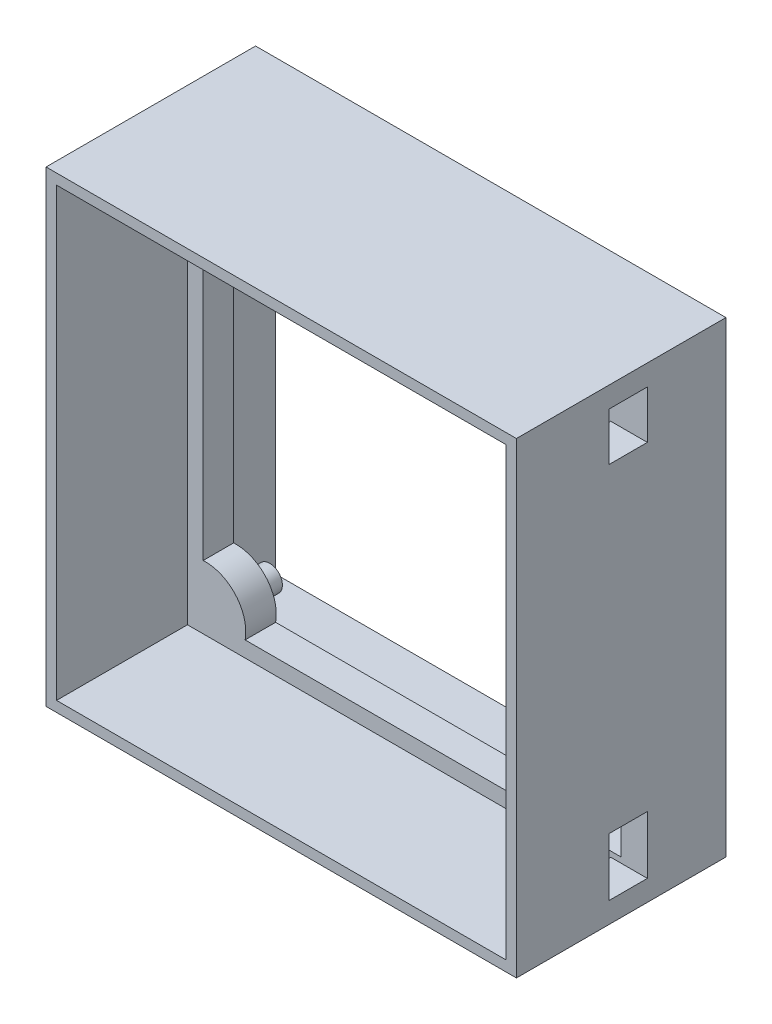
SolidWorks part; units mm, degrees
ref_plane "Front Plane" through (0, 0, 0) normal (0, 0, 1) x (1, 0, 0)
ref_plane "Top Plane" through (0, 0, 0) normal (0, 1, 0) x (1, 0, 0)
ref_plane "Right Plane" through (0, 0, 0) normal (1, 0, 0) x (0, 0, -1)
sketch "Sketch1" plane through (0, 0, 0) normal (0, 0, 1) x (1, 0, 0)
  line L0 (-44.9, -44.6) -> (-44.9, 44.6)
  line L1 (-39.9, -39.6) -> (39.9, -39.6)
  line L2 (-39.9, -39.6) -> (-39.9, 39.6)
  line L3 (-39.9, 39.6) -> (39.9, 39.6)
  line L4 (39.9, -39.6) -> (39.9, 39.6)
  line L5 (-39.9, -39.6) -> (39.9, 39.6) construction
  line L6 (-39.9, 39.6) -> (39.9, -39.6) construction
  line L7 (-44.9, 44.6) -> (44.9, 44.6)
  line L8 (44.9, -44.6) -> (44.9, 44.6)
  line L9 (-44.9, -44.6) -> (44.9, -44.6)
  point P0 (0, 0)
  dimension "D1" = 79.2
  dimension "D2" = 79.8
  dimension "D3" = 5
extrude "Boss-Extrude1" add sketch "Sketch1" along normal blind 40
sketch "Sketch2" plane through (0, 0, 40) normal (0, 0, 1) x (1, 0, 0)
  line L0 (39.9, -39.6) -> (39.9, 39.6) construction
  line L1 (39.9, 39.6) -> (-39.9, 39.6) construction
  line L2 (31.8973, 39.6) -> (39.9, 39.6)
  line L3 (39.9, 39.6) -> (39.9, 30.4655)
  line L4 (39.9, 0) -> (35.9467, 0)
  line L5 (39.9, -39.6) -> (39.9, -30.4655)
  line L6 (31.8973, -39.6) -> (39.9, -39.6)
  line L7 (0, 39.6) -> (0, 51.3482) construction
  line L8 (-31.8973, -39.6) -> (-39.9, -39.6)
  line L9 (-39.9, -39.6) -> (-39.9, -30.4655)
  line L10 (-39.9, 0) -> (-35.9467, 0)
  line L11 (-39.9, 39.6) -> (-39.9, 30.4655)
  line L12 (-31.8973, 39.6) -> (-39.9, 39.6)
  arc A0 (39.9, 30.4655) -> (31.8973, 39.6) centre (37.6432, 36.5611) cw
  arc A1 (39.9, -30.4655) -> (31.8973, -39.6) centre (37.6432, -36.5611) ccw
  arc A2 (-39.9, -30.4655) -> (-31.8973, -39.6) centre (-37.6432, -36.5611) cw
  arc A3 (-39.9, 30.4655) -> (-31.8973, 39.6) centre (-37.6432, 36.5611) ccw
  dimension "D1" = 6.5
extrude "Boss-Extrude2" add sketch "Sketch2" against normal blind 30.82 contours A3 M10 M7 | A0 M8 M7 | A2 M10 M9
sketch "Sketch3" plane through (0, 0, 40) normal (0, 0, 1) x (1, 0, 0)
  line L0 (-31.8973, -39.6) -> (39.9, -39.6) construction
  line L1 (30.704, -39.6) -> (20.704, -39.6)
  line L2 (30.704, -39.6) -> (30.704, -30.067)
  line L3 (30.704, -30.067) -> (20.704, -30.067)
  line L4 (20.704, -39.6) -> (20.704, -30.067)
  dimension "D1" = 10
extrude "Boss-Extrude3" add sketch "Sketch3" against normal blind 30.82 separate body
sketch "Sketch4" plane through (0, 0, 40) normal (0, 0, 1) x (1, 0, 0)
  line L0 (31.8973, 39.6) -> (-31.8973, 39.6) construction
  line L1 (39.9, -39.6) -> (-39.9, -39.6)
  line L2 (39.9, -39.6) -> (39.9, 39.6)
  line L3 (39.9, 39.6) -> (-39.9, 39.6)
  line L4 (-39.9, -39.6) -> (-39.9, 39.6)
  line L5 (-39.9, 30.4655) -> (-39.9, -30.4655) construction
  dimension "D1" = 0
  dimension "D2" = 0
extrude "Cut-Extrude1" cut sketch "Sketch4" against normal blind 25
sketch "Sketch6" plane through (0, 0, 9.18) normal (0, 0, -1) x (-1, 0, 0)
  line L0 (0, 39.6) -> (0, 35.6)
  line L1 (-39.9, 39.6) -> (39.9, 39.6) construction
  circle A0 centre (-36, 35.6) radius 7
  circle A1 centre (-36, 35.6) radius 2.25
  circle A3 centre (35.8, 35.4) radius 2.25
  circle A4 centre (35.5, -35.3) radius 2.25
  circle A5 centre (-26.2, -34.8) radius 2.25
  dimension "D1" = 14
  dimension "D2" = 4.5
  dimension "D3" = 4.5
  dimension "D4" = 4.5
  dimension "D5" = 4.5
extrude "Boss-Extrude4" add sketch "Sketch6" along normal blind 2.5 contours A1 | A3 | A4 | A5
sketch "Sketch7" plane through (0, 0, 15) normal (0, 0, 1) x (1, 0, 0)
  line L0 (-39.9, 0) -> (-37.6432, 0)
  line L1 (-39.9, 39.6) -> (-39.9, -39.6) construction
  arc A0 (-31.8973, -39.6) -> (-39.9, -30.4655) centre (-37.6432, -36.5611) ccw
  arc A1 (-31.8973, -39.6) -> (-39.9, -30.4655) centre (-39.5186, -38.2041) ccw
  arc A2 (-31.8973, 39.6) -> (-39.9, 30.4655) centre (-39.5186, 38.2041) cw
  arc A3 (-31.8973, 39.6) -> (-39.9, 30.4655) centre (-37.6432, 36.5611) cw
extrude "Cut-Extrude2" cut sketch "Sketch7" against normal blind 18 contours A3 A2 | A1 M2
sketch "Sketch8" plane through (0, 0, 6.68) normal (0, 0, -1) x (-1, 0, 0)
  circle A0 centre (-26.2, -34.8) radius 2.25
  circle A1 centre (-26.2, -34.8) radius 2.4
  circle A2 centre (-36, 35.6) radius 2.4
  circle A3 centre (35.8, 35.4) radius 2.4
  circle A4 centre (35.5, -35.3) radius 2.4
  dimension "D1" = 4.8
  dimension "D2" = 4.8
  dimension "D3" = 4.8
  dimension "D4" = 4.8
extrude "Boss-Extrude5" add sketch "Sketch8" against normal up to surface (8.32 mm away)
sketch "Sketch9" plane through (0, 0, 0) normal (0, 0, -1) x (-1, 0, 0)
  line L0 (-41.1, -40.8) -> (41.1, -40.8)
  line L1 (-39.9, -39.6) -> (39.9, -39.6)
  line L2 (-39.9, -39.6) -> (-39.9, 39.6)
  line L3 (-39.9, 39.6) -> (39.9, 39.6)
  line L4 (39.9, -39.6) -> (39.9, 39.6)
  line L5 (41.1, -40.8) -> (41.1, 40.8)
  line L6 (-41.1, 40.8) -> (41.1, 40.8)
  line L7 (-41.1, -40.8) -> (-41.1, 40.8)
  dimension "D1" = 1.2
extrude "Cut-Extrude3" cut sketch "Sketch9" against normal up to surface (9.18 mm away)
sketch "Sketch10" plane through (0, 0, 40) normal (0, 0, 1) x (1, 0, 0)
  line L0 (42.9, 42.6) -> (-42.9, 42.6)
  line L1 (39.9, 39.6) -> (-39.9, 39.6)
  line L2 (39.9, 39.6) -> (39.9, -39.6)
  line L3 (39.9, -39.6) -> (-39.9, -39.6)
  line L4 (-39.9, 39.6) -> (-39.9, -39.6)
  line L5 (-42.9, 42.6) -> (-42.9, -42.6)
  line L6 (42.9, -42.6) -> (-42.9, -42.6)
  line L7 (42.9, 42.6) -> (42.9, -42.6)
  dimension "D1" = 3
extrude "Cut-Extrude4" cut sketch "Sketch10" against normal up to surface (25 mm away)
sketch "Sketch11" plane through (42.9, 0, 0) normal (-1, 0, 0) x (0, 0, 1)
  line L0 (15, 42.6) -> (15, -42.6) construction
  line L1 (15, 40.63) -> (22.33, 40.63)
  line L2 (15, 40.63) -> (15, 31.46)
  line L3 (15, 31.46) -> (22.33, 31.46)
  line L4 (22.33, 40.63) -> (22.33, 31.46)
  line L5 (15, 42.6) -> (40, 42.6) construction
  line L6 (15, -42.6) -> (40, -42.6) construction
  line L7 (15, -40.63) -> (22.3, -40.63)
  line L8 (15, -40.63) -> (15, -29.57)
  line L9 (15, -29.57) -> (22.3, -29.57)
  line L10 (22.3, -40.63) -> (22.3, -29.57)
extrude "Cut-Extrude5" cut sketch "Sketch11" against normal blind 6
sketch "Sketch12" plane through (42.9, 0, 0) normal (-1, 0, 0) x (0, 0, 1)
  line L39 (15, 42.63) -> (15, 40.63)
  line L40 (15, 40.63) -> (22.33, 40.63)
  line L41 (22.33, 40.63) -> (22.33, 31.46)
  line L42 (15, 29.46) -> (24.33, 29.46)
  line L43 (24.33, 42.63) -> (15, 42.63)
  line L44 (24.33, 29.46) -> (24.33, 42.63)
  line L45 (15, 29.46) -> (24.33, 29.46)
  line L46 (24.33, 42.63) -> (15, 42.63)
  line L47 (24.33, 29.46) -> (24.33, 42.63)
  line L48 (22.33, 31.46) -> (15, 31.46)
  line L49 (15, 31.46) -> (15, 29.46)
  line L56 (15, -27.57) -> (15, -29.57)
  line L57 (15, -29.57) -> (22.3, -29.57)
  line L58 (22.3, -29.57) -> (22.3, -40.63)
  line L59 (15, -42.63) -> (24.3, -42.63)
  line L60 (24.3, -27.57) -> (15, -27.57)
  line L61 (24.3, -42.63) -> (24.3, -27.57)
  line L62 (15, -42.63) -> (24.3, -42.63)
  line L63 (24.3, -27.57) -> (15, -27.57)
  line L64 (24.3, -42.63) -> (24.3, -27.57)
  line L65 (22.3, -40.63) -> (15, -40.63)
  line L66 (15, -40.63) -> (15, -42.63)
  dimension "D1" = 2
  dimension "D2" = 2
extrude "Boss-Extrude6" add sketch "Sketch12" along normal blind 5
sketch "Sketch13" plane through (0, 0, 40) normal (0, 0, 1) x (1, 0, 0)
  line L17 (-44.9, -44.6) -> (44.9, -44.6)
  line L18 (44.9, -44.6) -> (44.9, 44.6)
  line L19 (44.9, 44.6) -> (-44.9, 44.6)
  line L20 (-44.9, 44.6) -> (-44.9, -44.6)
  line L21 (-44.9, -44.6) -> (44.9, -44.6)
  line L22 (44.9, -44.6) -> (44.9, 44.6)
  line L23 (44.9, 44.6) -> (-44.9, 44.6)
  line L24 (-44.9, 44.6) -> (-44.9, -44.6)
  line L35 (-42.9, -42.6) -> (42.9, -42.6)
  line L36 (42.9, -42.6) -> (42.9, 42.6)
  line L37 (42.9, 42.6) -> (-42.9, 42.6)
  line L38 (-42.9, 42.6) -> (-42.9, -42.6)
  line L39 (-42.9, -42.6) -> (42.9, -42.6)
  line L40 (42.9, -42.6) -> (42.9, 42.6)
  line L41 (42.9, 42.6) -> (-42.9, 42.6)
  line L42 (-42.9, 42.6) -> (-42.9, -42.6)
  dimension "D1" = 0
  dimension "D2" = 0
equation "\"D6@Sketch11\"=\"D3@Sketch11\""
